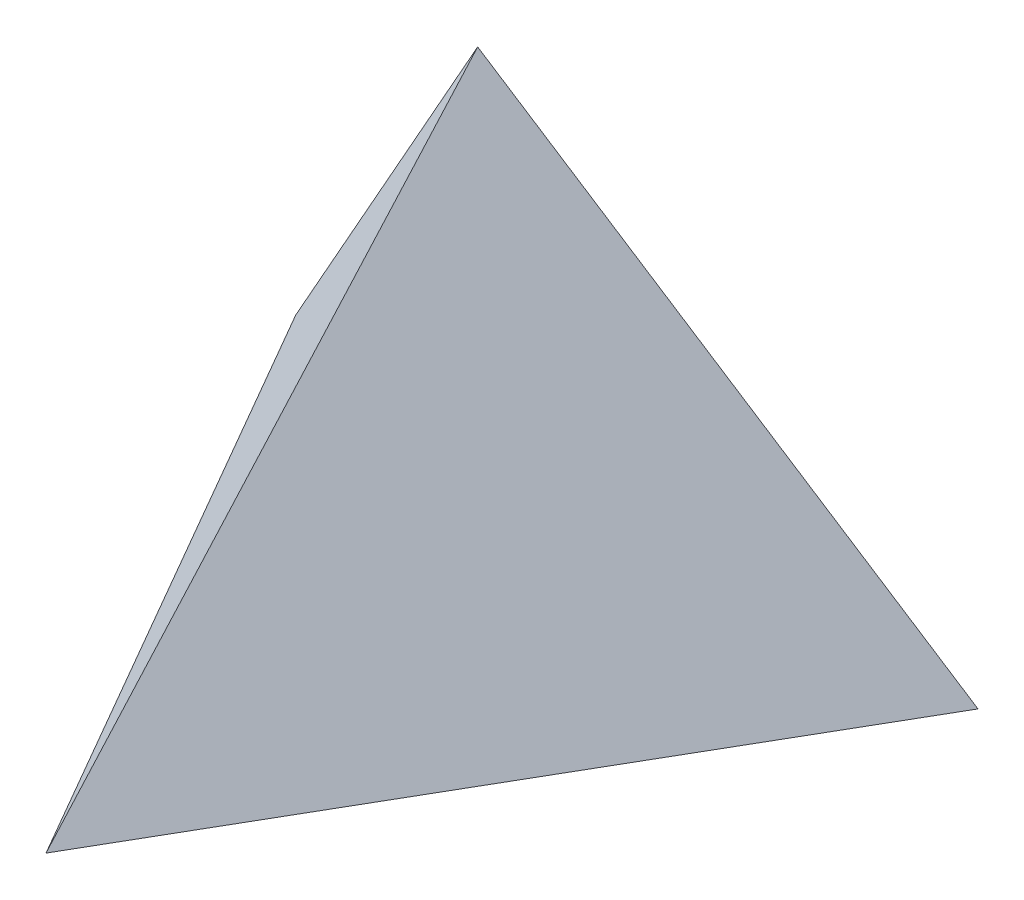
SolidWorks part; units mm, degrees
ref_plane "前视基准面" through (0, 0, 0) normal (0, 0, 1) x (1, 0, 0)
ref_plane "上视基准面" through (0, 0, 0) normal (0, 1, 0) x (1, 0, 0)
ref_plane "右视基准面" through (0, 0, 0) normal (1, 0, 0) x (0, 0, -1)
sketch3d "3D草图1"
  point P0 (0, 21.21, 0)
  dimension "D1" = 21.21
sketch "草图1" plane through (0, 0, 0) normal (0, 1, 0) x (1, 0, 0)
  line L0 (0, 51.1066) -> (0, -47.093) construction
  line L1 (15, 7) -> (-15, 7)
  line L2 (-15, 7) -> (0, -18.9808)
  line L3 (-28.229, 0) -> (34.3832, 0) construction
  line L4 (15, 7) -> (0, -18.9808)
  point P9 (0, 7)
  dimension "D1" = 15
  dimension "D2" = 30
  dimension "D3" = 7
loft "放样3" add profiles "3D草图1", "草图1"
